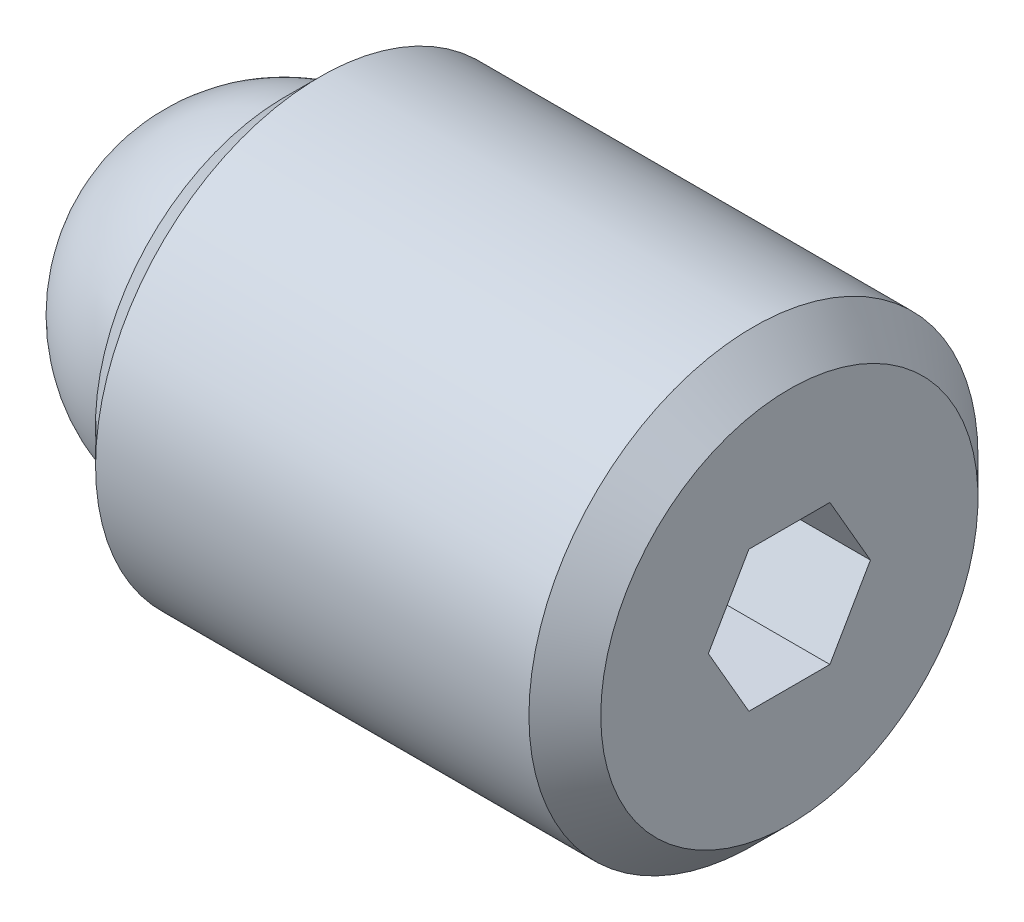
SolidWorks part; units mm, degrees
ref_plane "Front Plane" through (0, 0, 0) normal (0, 0, 1) x (1, 0, 0)
ref_plane "Top Plane" through (0, 0, 0) normal (0, 1, 0) x (1, 0, 0)
ref_plane "Right Plane" through (0, 0, 0) normal (1, 0, 0) x (0, 0, -1)
sketch "Sketch2" plane through (0, 0, 0) normal (1, 0, 0) x (0, 0, -1)
  circle A0 centre (0, 0) radius 3.175
  dimension "D1" = 6.35
extrude "Boss-Extrude1" add sketch "Sketch2" along normal blind 7.1437
sketch "Sketch3" plane through (0, 0, 0) normal (-1, 0, 0) x (0, 0, 1)
  circle A0 centre (0, 0) radius 2.3813
  dimension "D1" = 4.7625
chamfer "Chamfer1" distance 0.508 angle 45 1 edges at (0, 0, -3.175)
chamfer "Chamfer2" distance 0.508 angle 45 1 edges at (7.1437, 0, -3.175)
sketch "Sketch4" plane through (7.1437, 0, 0) normal (1, 0, 0) x (0, 0, -1)
  line L1 (1.1457, 0) -> (0.5728, 0.9922)
  line L2 (0.5728, 0.9922) -> (-0.5728, 0.9922)
  line L3 (-0.5728, 0.9922) -> (-1.1457, 0)
  line L4 (-1.1457, 0) -> (-0.5728, -0.9922)
  line L5 (-0.5728, -0.9922) -> (0.5728, -0.9922)
  line L6 (0.5728, -0.9922) -> (1.1457, 0)
  circle A0 centre (0, 0) radius 0.9922 construction
  dimension "D1" = 1.9844
extrude "Cut-Extrude2" cut sketch "Sketch4" against normal blind 2.286
extrude "Cut-Extrude3" cut sketch "Sketch3" against normal blind 2.3813
sketch "Sketch5" plane through (0, 0, 0) normal (-1, 0, 0) x (0, 0, 1)
  line L0 (0, 0) -> (0, -2.3813)
  line L1 (0, 0) -> (0, 2.3813)
  arc A0 (0, 2.3813) -> (0, -2.3813) centre (0, 0) ccw
  dimension "D1" = 2.3813
revolve "Revolve1" add sketch "Sketch5" angle 360 about L1
sketch "Sketch7" plane through (0, 0, 0) normal (-1, 0, 0) x (0, 0, 1)
  line L0 (0, 0) -> (0, 2.3813) construction
  circle A0 centre (0, 0) radius 2.3813 construction
  arc A1 (0.0635, 2.3804) -> (-0.0635, 2.3804) centre (0, 0) ccw
  arc A2 (0.0635, 2.3804) -> (-0.0635, 2.3804) centre (0, 2.3813) ccw
  dimension "D1" = 0.127
extrude "Cut-Extrude4" cut sketch "Sketch7" against normal up to surface (2.3813 mm away) contours A2 A1
